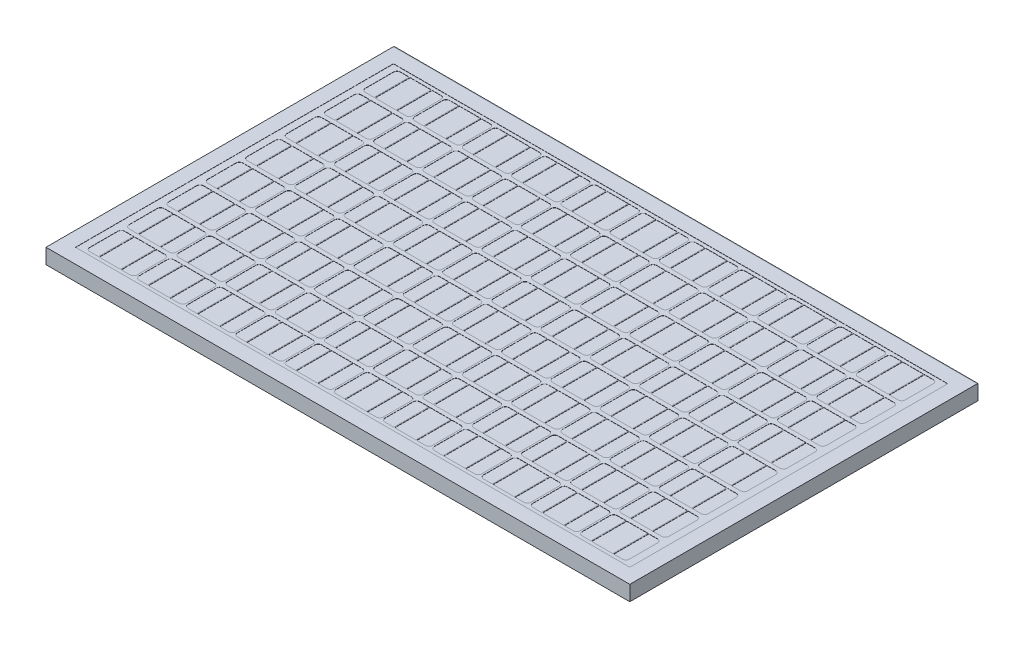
SolidWorks part; units mm, degrees
ref_plane "Front Plane" through (0, 0, 0) normal (0, 0, 1) x (1, 0, 0)
ref_plane "Top Plane" through (0, 0, 0) normal (0, 1, 0) x (1, 0, 0)
ref_plane "Right Plane" through (0, 0, 0) normal (1, 0, 0) x (0, 0, -1)
imported_body "Imported1"
hole_wizard "Ø8.0 (8) Diameter Hole1" positions "Sketch3" profile "Sketch1" hole size "Ø8.0" standard "ANSI Metric"
sketch "Sketch3" plane through (0, -21.5, 0) normal (0, -1, 0) x (-1, 0, 0)
  point P0 (562.8936, -483.9792)
  point P3 (187.9548, -483.9792)
  point P6 (-188.0324, -483.9792)
  point P9 (-563.0964, -483.9792)
  point P12 (562.8936, 476.2468)
  point P15 (187.9548, 476.2468)
  point P18 (-188.0324, 476.2468)
  point P21 (-563.0964, 476.2468)
sketch "Sketch1" plane through (-562.8936, -21.5, 483.9792) normal (1, 0, 0) x (0, 0, -1)
  line L0 (0, 0) -> (0, 7.4034)
  line L1 (0, 7.4034) -> (4, 5)
  line L2 (4, 5) -> (4, 0)
  line L5 (4, 0) -> (0, 0)
  line L10 (0, 7.4034) -> (-4, 5) construction
  line L11 (0, -6.35) -> (0, 107.95) construction
  dimension "Hole Dia." = 8
  dimension "Hole Depth" = 5
  dimension "Drill Angle" = 118
scale "Echelle1" scale about centroid uniform scaling yes scale factor 0.778986
